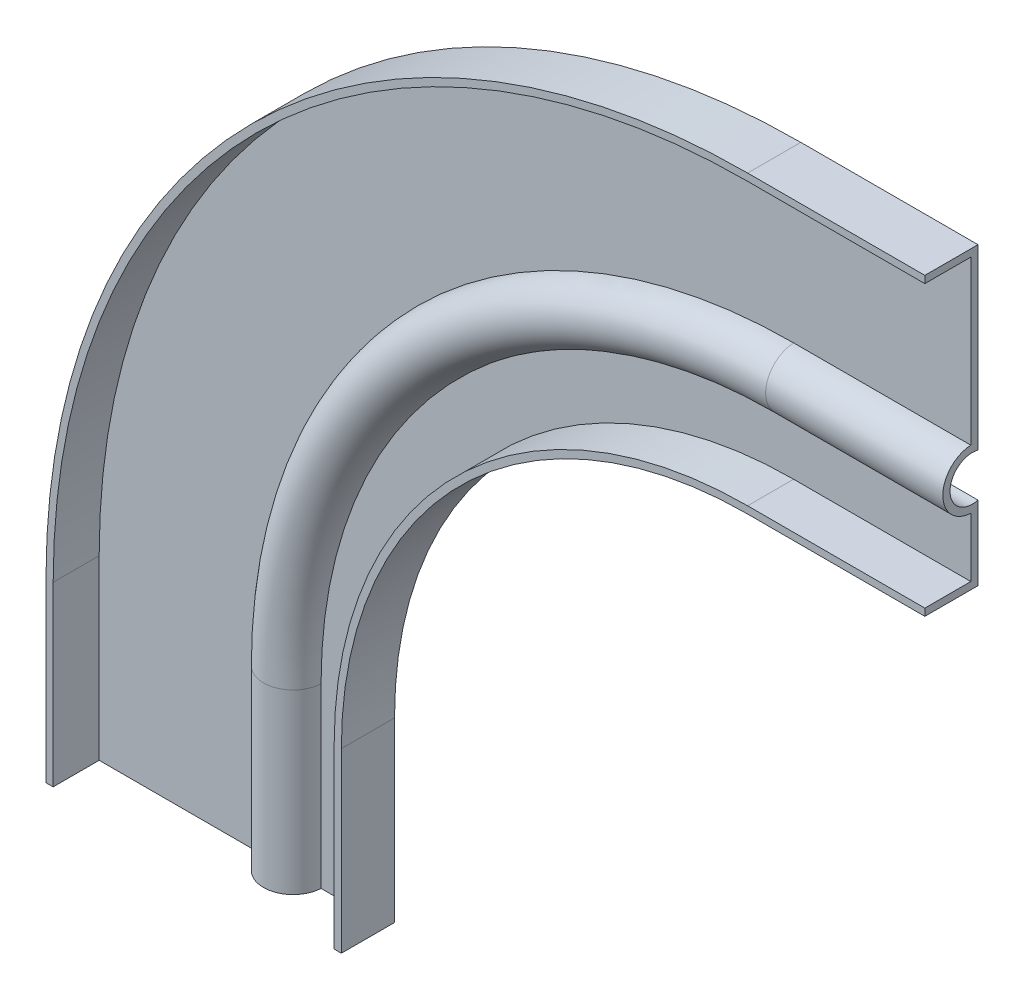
SolidWorks part; units mm, degrees
ref_plane "Front Plane" through (0, 0, 0) normal (0, 0, 1) x (1, 0, 0)
ref_plane "Top Plane" through (0, 0, 0) normal (0, 1, 0) x (1, 0, 0)
ref_plane "Right Plane" through (0, 0, 0) normal (1, 0, 0) x (0, 0, -1)
sketch "Sketch1" plane through (0, 0, 0) normal (0, 0, 1) x (1, 0, 0)
  line L0 (0, 0) -> (50, 0) construction
  line L1 (50, 0) -> (50, 30) construction
  line L2 (70, 50) -> (100, 50) construction
  line L3 (100, 50) -> (100, 100) construction
  line L4 (100, 100) -> (70, 100)
  line L5 (0, 30) -> (0, 0)
  arc A0 (50, 30) -> (70, 50) centre (70, 30) cw construction
  arc A1 (70, 100) -> (0, 30) centre (70, 30) ccw
  dimension "D3" = 20
  dimension "D1" = 30
  dimension "D2" = 50
sketch "Sketch4" plane through (0, 0, 0) normal (0, 1, 0) x (1, 0, 0)
  line L0 (0, 0) -> (0, -7.786)
  line L1 (0, -7.786) -> (1.214, -7.786)
  line L2 (1.214, -7.786) -> (1.214, 1.214)
  line L3 (1.214, 1.214) -> (-11.3358, 1.214)
  line L4 (-18.6642, 1.214) -> (-48.786, 1.214)
  line L5 (-48.786, 1.214) -> (-48.786, -7.786)
  line L6 (-48.786, -7.786) -> (-47.572, -7.786)
  line L7 (-47.572, -7.786) -> (-47.572, 0)
  line L8 (-47.572, 0) -> (-19.9932, 0)
  line L9 (-10.0068, 0) -> (0, 0)
  arc A0 (-18.6642, 1.214) -> (-11.3358, 1.214) centre (-15, 0.2616) ccw
  arc A1 (-19.9932, 0) -> (-10.0068, 0) centre (-15, 0.2616) ccw
  dimension "D1" = 5
  dimension "D8" = 1.214
  dimension "D2" = 9
  dimension "D3" = 9
  dimension "D4" = 15
  dimension "D5" = 1.214
  dimension "D6" = 1.214
  dimension "D7" = 1.214
  dimension "D9" = 50
sweep "Sweep1" add profiles "Sketch4" path "Sketch1"
